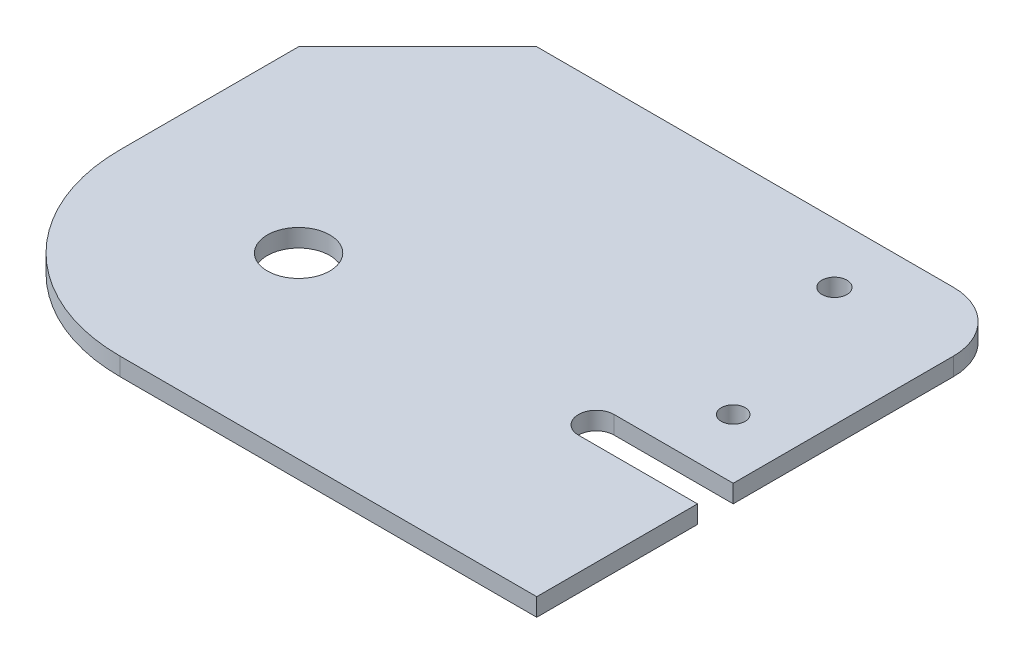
SolidWorks part; units mm, degrees
ref_plane "Front Plane" through (0, 0, 0) normal (0, 0, 1) x (1, 0, 0)
ref_plane "Top Plane" through (0, 0, 0) normal (0, 1, 0) x (1, 0, 0)
ref_plane "Right Plane" through (0, 0, 0) normal (1, 0, 0) x (0, 0, -1)
sketch "Sketch1" plane through (0, 0, 0) normal (0, 1, 0) x (1, 0, 0)
  line L0 (20, 80) -> (0, 60)
  line L1 (30, 0) -> (100, 0)
  line L2 (0, 30) -> (0, 60)
  line L3 (20, 80) -> (90, 80)
  line L4 (100, 0) -> (100, 27)
  line L5 (80, 33) -> (100, 33)
  line L6 (80, 27) -> (100, 27)
  line L7 (100, 33) -> (100, 70)
  circle A0 centre (30, 30) radius 5.25
  arc A1 (80, 33) -> (80, 27) centre (80, 30) ccw
  circle A2 centre (90, 43) radius 2
  arc A3 (30, 0) -> (0, 30) centre (30, 30) cw
  arc A4 (100, 70) -> (90, 80) centre (90, 70) ccw
  point P17 (0, 0)
  dimension "D1" = 30
  dimension "D4" = 30
  dimension "D5" = 30
  dimension "D8" = 20
  dimension "D9" = 10
  dimension "D11" = 30
  dimension "D13" = 10
  dimension "D14" = 10.5
  dimension "D15" = 4
  dimension "D2" = 20
  dimension "D3" = 20
  dimension "D6" = 30
  dimension "D7" = 6
  dimension "D10" = 80
  dimension "D12" = 10
extrude "Extrude1" add sketch "Sketch1" along normal blind 3
sketch "Sketch2" plane through (0, 3, 0) normal (0, 1, 0) x (1, 0, 0)
  line L0 (100, 33) -> (100, 70) construction
  line L1 (90, 80) -> (20, 80) construction
  point P0 (80, 70)
  dimension "D1" = 20
  dimension "D2" = 10
hole_wizard "M5 Tapped Hole1" positions "3DSketch1" profile "Sketch3" tap size "M5" standard "ISO"
sketch3d "3DSketch1"
  point P0 (80, 3, -70)
sketch "Sketch3" plane through (80, 3, -70) normal (1, 0, 0) x (0, 0, 1)
  line L0 (0, 0) -> (0, 3)
  line L1 (0, 3) -> (2.1, 3)
  line L2 (2.1, 3) -> (2.1, 0)
  line L5 (2.1, 0) -> (0, 0)
  line L11 (0, -6.35) -> (0, 107.95) construction
  dimension "Thru Tap Drill Dia." = 4.2
  dimension "Thru Tap Drill Depth" = 3
